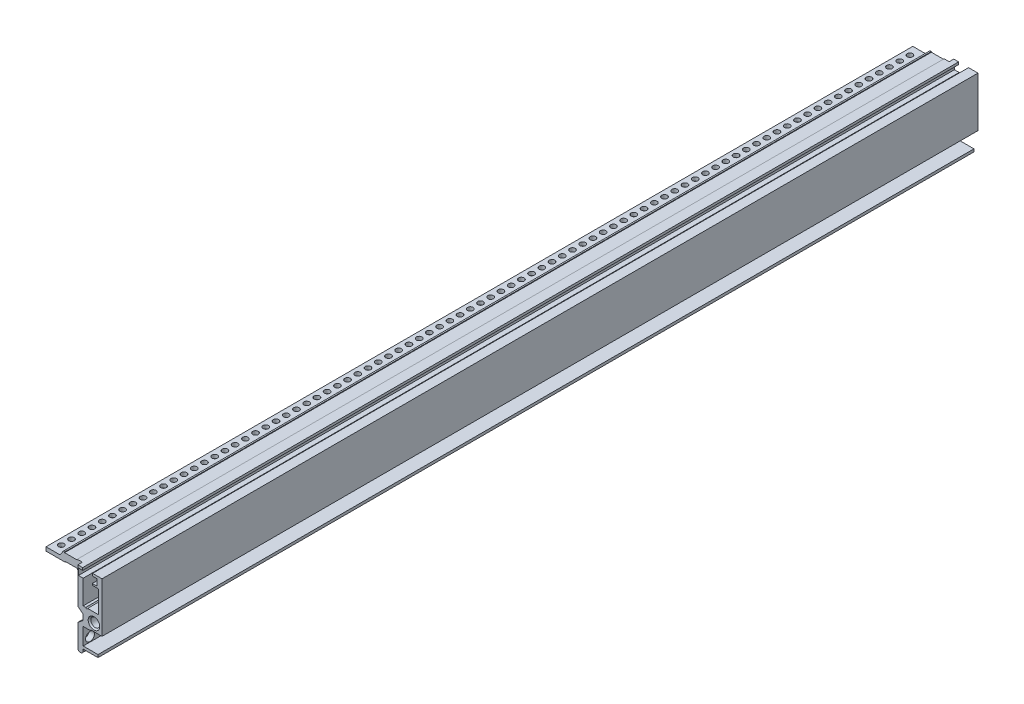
SolidWorks part; units mm, degrees
ref_plane "前视基准面" through (0, 0, 0) normal (0, 0, 1) x (1, 0, 0)
ref_plane "上视基准面" through (0, 0, 0) normal (0, 1, 0) x (1, 0, 0)
ref_plane "右视基准面" through (0, 0, 0) normal (1, 0, 0) x (0, 0, -1)
sketch "Model" plane through (0, 0, 0) normal (0, 0, 1) x (1, 0, 0)
  line L0 (2281.8705, 1522.2598) -> (2281.8705, 1503.7598)
  line L1 (2277.6705, 1503.7598) -> (2277.6705, 1503.4598)
  line L2 (2280.6205, 1518.3598) -> (2280.6205, 1510.0598)
  line L3 (2278.3705, 1522.2598) -> (2278.3705, 1521.3598)
  line L4 (2274.6705, 1522.2598) -> (2274.6705, 1521.3598)
  line L5 (2270.9705, 1522.2598) -> (2270.9705, 1522.0098)
  line L6 (2281.8705, 1522.2598) -> (2278.3705, 1522.2598)
  line L7 (2281.8705, 1503.7598) -> (2277.6705, 1503.7598)
  line L8 (2280.3705, 1496.1598) -> (2274.8705, 1496.1598)
  line L9 (2280.3705, 1497.1598) -> (2274.8705, 1497.1598)
  line L10 (2280.6205, 1518.3598) -> (2278.2705, 1518.3598)
  line L11 (2280.6205, 1510.0598) -> (2276.5105, 1510.0598)
  line L12 (2275.8305, 1510.0598) -> (2274.8705, 1510.0598)
  line L13 (2279.9205, 1518.9598) -> (2278.2705, 1518.9598)
  line L14 (2279.9205, 1521.3598) -> (2278.3705, 1521.3598)
  line L15 (2274.6705, 1522.2598) -> (2270.9705, 1522.2598)
  line L16 (2266.5705, 1519.0598) -> (2259.3705, 1519.0598)
  line L17 (2270.9705, 1519.3098) -> (2266.5705, 1519.3098)
  line L18 (2264.5705, 1520.4598) -> (2259.3705, 1520.4598)
  line L19 (2270.9705, 1522.0098) -> (2266.2705, 1522.0098)
  line L20 (2259.3705, 1520.4598) -> (2259.3705, 1519.0598)
  line L21 (2266.5705, 1519.3098) -> (2266.5705, 1519.0598)
  line L22 (2266.2705, 1522.2598) -> (2266.2705, 1522.0098)
  line L23 (2266.2705, 1522.2598) -> (2265.7705, 1522.2598)
  line L24 (2272.8705, 1516.5598) -> (2272.8705, 1508.9598)
  line L25 (2272.8705, 1503.7598) -> (2272.8705, 1495.5598)
  line L26 (2280.3705, 1497.1598) -> (2280.3705, 1496.1598)
  line L27 (2274.8705, 1496.1598) -> (2274.8705, 1495.5598)
  line L28 (2274.8705, 1507.3598) -> (2274.8705, 1505.3598)
  line L29 (2274.6705, 1521.3598) -> (2273.1205, 1521.3598)
  line L30 (2279.9205, 1521.3598) -> (2279.9205, 1518.9598)
  line L31 (2273.1205, 1521.3598) -> (2273.1205, 1518.9598)
  line L32 (2274.8705, 1518.9598) -> (2273.1205, 1518.9598)
  line L33 (2270.9705, 1519.3098) -> (2270.9705, 1519.0598)
  line L34 (2278.2705, 1518.9598) -> (2278.2705, 1518.3598)
  line L35 (2272.8705, 1508.9598) -> (2274.8705, 1507.3598)
  line L36 (2274.8705, 1505.3598) -> (2272.8705, 1503.7598)
  line L37 (2274.8705, 1518.9598) -> (2274.8705, 1510.0598)
  line L38 (2277.6705, 1503.4598) -> (2274.8705, 1503.4598)
  line L39 (2274.8705, 1497.1598) -> (2274.8705, 1503.4598)
  line L43 (2264.5705, 1520.4598) -> (2265.7705, 1522.2598)
  line L44 (2270.9705, 1519.0598) -> (2272.8705, 1516.5598)
  arc A0 (2275.8305, 1510.0598) -> (2276.5105, 1510.0598) centre (2276.1705, 1510.0598) ccw
  arc A1 (2272.8705, 1495.5598) -> (2274.8705, 1495.5598) centre (2273.8705, 1495.5598) ccw
extrude "凸台-拉伸1" add sketch "Model" along normal blind 325.12
hole_wizard "M4 螺纹孔1" positions "草图3" profile "草图2" tap size "M4" standard "Gb"
sketch "草图3" plane through (0, 0, 325.12) normal (0, 0, 1) x (1, 0, 0)
  line L0 (2281.8705, 1503.7598) -> (2281.8705, 1522.2598) construction
  line L1 (2281.8705, 1522.2598) -> (2278.3705, 1522.2598) construction
  point P0 (2278.8705, 1506.4598)
  dimension "D1" = 3
  dimension "D2" = 15.8
sketch "草图2" plane through (2278.8705, 1506.4598, 325.12) normal (1, 0, 0) x (0, -1, 0)
  line L0 (0, 0) -> (0, 24.4914)
  line L1 (0, 24.4914) -> (1.65, 23.5)
  line L2 (1.65, 23.5) -> (1.65, 0)
  line L5 (1.65, 0) -> (0, 0)
  line L10 (0, 24.4914) -> (-1.65, 23.5) construction
  line L11 (0, -6.35) -> (0, 107.95) construction
  dimension "螺纹孔钻头直径" = 3.3
  dimension "螺纹孔钻头深度" = 23.5
  dimension "导头角度" = 118
hole_wizard "M4 螺纹孔2" positions "草图5" profile "草图4" tap size "M4" standard "Gb"
sketch "草图5" plane through (0, 0, 0) normal (0, 0, -1) x (-1, 0, 0)
  line L0 (-2281.8705, 1503.7598) -> (-2281.8705, 1522.2598) construction
  line L1 (-2281.8705, 1522.2598) -> (-2278.3705, 1522.2598) construction
  point P0 (-2278.8705, 1506.4598)
  dimension "D1" = 3
  dimension "D2" = 15.8
sketch "草图4" plane through (2278.8705, 1506.4598, 0) normal (1, 0, 0) x (0, 1, 0)
  line L0 (0, 0) -> (0, 24.4914)
  line L1 (0, 24.4914) -> (1.65, 23.5)
  line L2 (1.65, 23.5) -> (1.65, 0)
  line L5 (1.65, 0) -> (0, 0)
  line L10 (0, 24.4914) -> (-1.65, 23.5) construction
  line L11 (0, -6.35) -> (0, 107.95) construction
  dimension "螺纹孔钻头直径" = 3.3
  dimension "螺纹孔钻头深度" = 23.5
  dimension "导头角度" = 118
chamfer "倒角1" distance 0.5 angle 45 2 edges at (2277.2205, 1506.4598, 0) (2280.5205, 1506.4598, 325.12)
sketch "草图6" plane through (2272.8705, 0, 0) normal (-1, 0, 0) x (0, 0, 1)
  line L0 (325.12, 1503.7598) -> (325.12, 1495.5598) construction
  line L1 (325.12, 1522.2598) -> (0, 1522.2598) construction
  circle A0 centre (322.58, 1498.9598) radius 1.65
  circle A1 centre (317.5, 1498.9598) radius 1.65
  circle A2 centre (312.42, 1498.9598) radius 1.65
  circle A3 centre (307.34, 1498.9598) radius 1.65
  circle A4 centre (302.26, 1498.9598) radius 1.65
  circle A5 centre (297.18, 1498.9598) radius 1.65
  circle A6 centre (292.1, 1498.9598) radius 1.65
  circle A7 centre (287.02, 1498.9598) radius 1.65
  circle A8 centre (281.94, 1498.9598) radius 1.65
  circle A9 centre (276.86, 1498.9598) radius 1.65
  circle A10 centre (271.78, 1498.9598) radius 1.65
  circle A11 centre (266.7, 1498.9598) radius 1.65
  circle A12 centre (261.62, 1498.9598) radius 1.65
  circle A13 centre (256.54, 1498.9598) radius 1.65
  circle A14 centre (251.46, 1498.9598) radius 1.65
  circle A15 centre (246.38, 1498.9598) radius 1.65
  circle A16 centre (241.3, 1498.9598) radius 1.65
  circle A17 centre (236.22, 1498.9598) radius 1.65
  circle A18 centre (231.14, 1498.9598) radius 1.65
  circle A19 centre (226.06, 1498.9598) radius 1.65
  circle A20 centre (220.98, 1498.9598) radius 1.65
  circle A21 centre (215.9, 1498.9598) radius 1.65
  circle A22 centre (210.82, 1498.9598) radius 1.65
  circle A23 centre (205.74, 1498.9598) radius 1.65
  circle A24 centre (200.66, 1498.9598) radius 1.65
  circle A25 centre (195.58, 1498.9598) radius 1.65
  circle A26 centre (190.5, 1498.9598) radius 1.65
  circle A27 centre (185.42, 1498.9598) radius 1.65
  circle A28 centre (180.34, 1498.9598) radius 1.65
  circle A29 centre (175.26, 1498.9598) radius 1.65
  circle A30 centre (170.18, 1498.9598) radius 1.65
  circle A31 centre (165.1, 1498.9598) radius 1.65
  circle A32 centre (160.02, 1498.9598) radius 1.65
  circle A33 centre (154.94, 1498.9598) radius 1.65
  circle A34 centre (149.86, 1498.9598) radius 1.65
  circle A35 centre (144.78, 1498.9598) radius 1.65
  circle A36 centre (139.7, 1498.9598) radius 1.65
  circle A37 centre (134.62, 1498.9598) radius 1.65
  circle A38 centre (129.54, 1498.9598) radius 1.65
  circle A39 centre (124.46, 1498.9598) radius 1.65
  circle A40 centre (119.38, 1498.9598) radius 1.65
  circle A41 centre (114.3, 1498.9598) radius 1.65
  circle A42 centre (109.22, 1498.9598) radius 1.65
  circle A43 centre (104.14, 1498.9598) radius 1.65
  circle A44 centre (99.06, 1498.9598) radius 1.65
  circle A45 centre (93.98, 1498.9598) radius 1.65
  circle A46 centre (88.9, 1498.9598) radius 1.65
  circle A47 centre (83.82, 1498.9598) radius 1.65
  circle A48 centre (78.74, 1498.9598) radius 1.65
  circle A49 centre (73.66, 1498.9598) radius 1.65
  circle A50 centre (68.58, 1498.9598) radius 1.65
  circle A51 centre (63.5, 1498.9598) radius 1.65
  circle A52 centre (58.42, 1498.9598) radius 1.65
  circle A53 centre (53.34, 1498.9598) radius 1.65
  circle A54 centre (48.26, 1498.9598) radius 1.65
  circle A55 centre (43.18, 1498.9598) radius 1.65
  circle A56 centre (38.1, 1498.9598) radius 1.65
  circle A57 centre (33.02, 1498.9598) radius 1.65
  circle A58 centre (27.94, 1498.9598) radius 1.65
  circle A59 centre (22.86, 1498.9598) radius 1.65
  circle A60 centre (17.78, 1498.9598) radius 1.65
  circle A61 centre (12.7, 1498.9598) radius 1.65
  circle A62 centre (7.62, 1498.9598) radius 1.65
  circle A63 centre (2.54, 1498.9598) radius 1.65
extrude "切除-拉伸1" cut sketch "草图6" against normal blind 10
hole_wizard "M2.5 螺纹孔1"
sketch "草图8" plane through (0, 1520.4598, 0) normal (0, 1, 0) x (1, 0, 0)
  line L0 (2264.5705, -325.12) -> (2259.3705, -325.12) construction
  line L1 (2259.3705, -325.12) -> (2259.3705, 0) construction
  line L2 (2264.5705, 0) -> (2259.3705, 0) construction
  point P0 (2261.6705, -320.04)
  point P13 (2261.6705, -316.2453)
  point P14 (2261.6705, -312.4506)
  point P15 (2261.6705, -308.6559)
  point P16 (2261.6705, -304.8612)
  point P17 (2261.6705, -301.0665)
  point P18 (2261.6705, -297.2718)
  point P19 (2261.6705, -293.4771)
  point P20 (2261.6705, -289.6824)
  point P21 (2261.6705, -285.8877)
  point P22 (2261.6705, -282.093)
  point P23 (2261.6705, -278.2983)
  point P24 (2261.6705, -274.5036)
  point P25 (2261.6705, -270.7089)
  point P26 (2261.6705, -266.9142)
  point P27 (2261.6705, -263.1195)
  point P28 (2261.6705, -259.3248)
  point P29 (2261.6705, -255.5301)
  point P30 (2261.6705, -251.7354)
  point P31 (2261.6705, -247.9407)
  point P32 (2261.6705, -244.146)
  point P33 (2261.6705, -240.3513)
  point P34 (2261.6705, -236.5566)
  point P35 (2261.6705, -232.7619)
  point P36 (2261.6705, -228.9672)
  point P37 (2261.6705, -225.1725)
  point P38 (2261.6705, -221.3778)
  point P39 (2261.6705, -217.5831)
  point P40 (2261.6705, -213.7884)
  point P41 (2261.6705, -209.9937)
  point P42 (2261.6705, -206.199)
  point P43 (2261.6705, -202.4043)
  point P44 (2261.6705, -198.6096)
  point P45 (2261.6705, -194.8149)
  point P46 (2261.6705, -191.0202)
  point P47 (2261.6705, -187.2255)
  point P48 (2261.6705, -183.4308)
  point P49 (2261.6705, -179.6361)
  point P50 (2261.6705, -175.8414)
  point P51 (2261.6705, -172.0467)
  point P52 (2261.6705, -168.252)
  point P53 (2261.6705, -164.4573)
  point P54 (2261.6705, -160.6627)
  point P55 (2261.6705, -156.868)
  point P56 (2261.6705, -153.0733)
  point P57 (2261.6705, -149.2786)
  point P58 (2261.6705, -145.4839)
  point P59 (2261.6705, -141.6892)
  point P60 (2261.6705, -137.8945)
  point P61 (2261.6705, -134.0998)
  point P62 (2261.6705, -130.3051)
  point P63 (2261.6705, -126.5104)
  point P64 (2261.6705, -122.7157)
  point P65 (2261.6705, -118.921)
  point P66 (2261.6705, -115.1263)
  point P67 (2261.6705, -111.3316)
  point P68 (2261.6705, -107.5369)
  point P69 (2261.6705, -103.7422)
  point P70 (2261.6705, -99.9475)
  point P71 (2261.6705, -96.1528)
  point P72 (2261.6705, -92.3581)
  point P73 (2261.6705, -88.5634)
  point P74 (2261.6705, -84.7687)
  point P75 (2261.6705, -80.974)
  point P76 (2261.6705, -77.1793)
  point P77 (2261.6705, -73.3846)
  point P78 (2261.6705, -69.5899)
  point P79 (2261.6705, -65.7952)
  point P80 (2261.6705, -62.0005)
  point P81 (2261.6705, -58.2058)
  point P82 (2261.6705, -54.4111)
  point P83 (2261.6705, -50.6164)
  point P84 (2261.6705, -46.8217)
  point P85 (2261.6705, -43.027)
  point P86 (2261.6705, -39.2323)
  point P87 (2261.6705, -35.4376)
  point P88 (2261.6705, -31.6429)
  point P89 (2261.6705, -27.8482)
  point P90 (2261.6705, -24.0535)
  point P91 (2261.6705, -20.2588)
  point P92 (2261.6705, -16.4641)
  point P93 (2261.6705, -12.6694)
  point P94 (2261.6705, -8.8747)
  point P95 (2261.6705, -5.08)
  dimension "D1" = 5.08
  dimension "D2" = 2.3
  dimension "D4" = 5.08
  dimension "D3" = 84
sketch "草图7" plane through (2261.6705, 1520.4598, 320.04) normal (1, 0, 0) x (0, 0, 1)
  line L0 (0, 0) -> (0, 7.8659)
  line L1 (0, 7.8659) -> (1.025, 7.25)
  line L2 (1.025, 7.25) -> (1.025, 0)
  line L5 (1.025, 0) -> (0, 0)
  line L10 (0, 7.8659) -> (-1.025, 7.25) construction
  line L11 (0, -6.35) -> (0, 107.95) construction
  dimension "螺纹孔钻头直径" = 2.05
  dimension "螺纹孔钻头深度" = 7.25
  dimension "导头角度" = 118
sketch "草图9" plane through (0, 1519.0598, 0) normal (0, -1, 0) x (1, 0, 0)
  line L0 (2272.8705, 325.12) -> (2272.8705, 0) construction
  line L2 (2259.3705, 325.12) -> (2272.8705, 325.12)
  line L3 (2259.3705, 325.12) -> (2259.3705, 323.42)
  line L4 (2259.3705, 323.42) -> (2272.8705, 323.42)
  line L5 (2272.8705, 325.12) -> (2272.8705, 323.42)
  line L6 (2259.3705, 0) -> (2272.8705, 0)
  line L7 (2259.3705, 0) -> (2259.3705, 1.7)
  line L8 (2259.3705, 1.7) -> (2272.8705, 1.7)
  line L9 (2272.8705, 0) -> (2272.8705, 1.7)
  dimension "D1" = 1.7
  dimension "D2" = 1.7
extrude "切除-拉伸2" cut sketch "草图9" against normal through all and the other way through all
equation "\"D4@草图6\"=\"D1@凸台-拉伸1\"/5.08"
